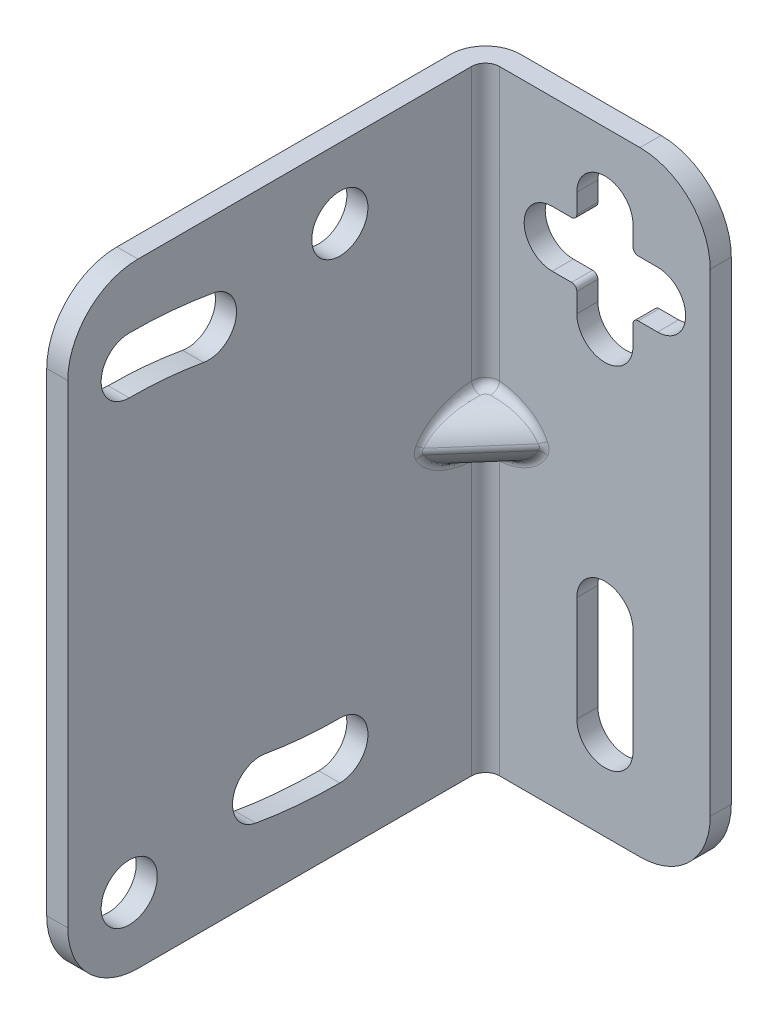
SolidWorks part; units mm, degrees
ref_plane "정면" through (0, 0, 0) normal (0, 0, 1) x (1, 0, 0)
ref_plane "윗면" through (0, 0, 0) normal (0, 1, 0) x (1, 0, 0)
ref_plane "우측면" through (0, 0, 0) normal (1, 0, 0) x (0, 0, -1)
imported_body "BRACKET 1"
other "면 이동1" parameters "D1"=1
other "면 이동2" parameters "D1"=1
